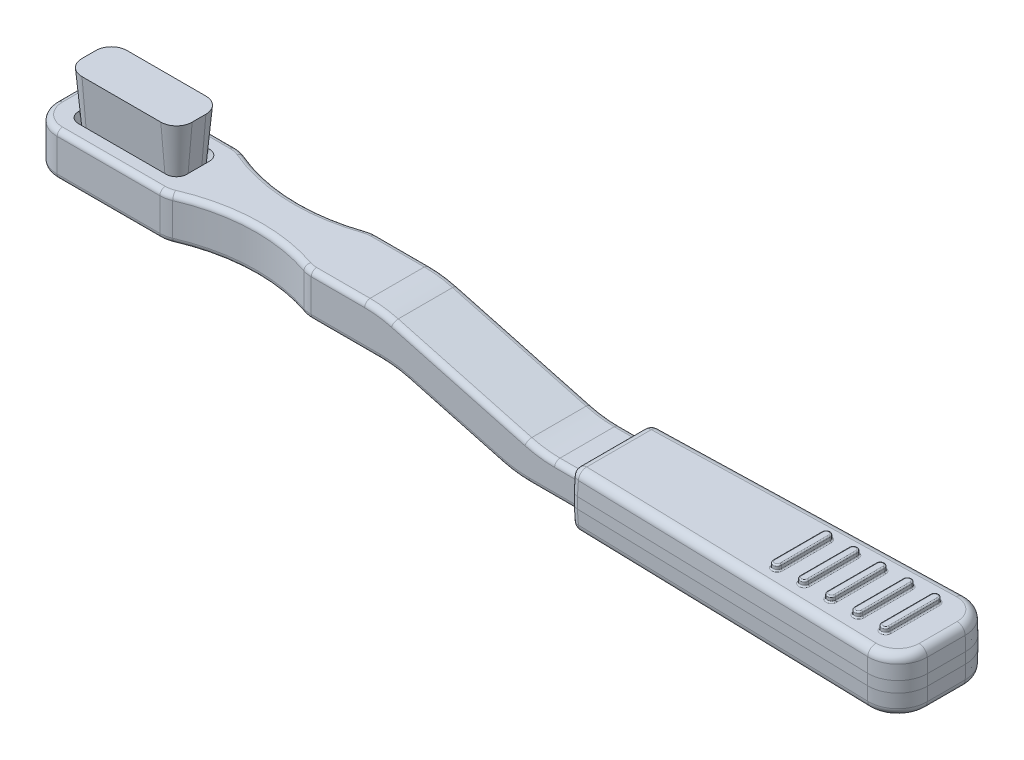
SolidWorks part; units mm, degrees
ref_plane "Front Plane" through (0, 0, 0) normal (0, 0, 1) x (1, 0, 0)
ref_plane "Top Plane" through (0, 0, 0) normal (0, 1, 0) x (1, 0, 0)
ref_plane "Right Plane" through (0, 0, 0) normal (1, 0, 0) x (0, 0, -1)
ref_plane "Plane1" through (0, -3, 0) normal (0, 1, 0) x (1, 0, 0)
sketch "Sketch1" plane through (0, 0, 0) normal (0, 1, 0) x (1, 0, 0)
  line L0 (0, 0) -> (160, 0)
  line L1 (160, 6) -> (49.98, 6)
  line L2 (25, 7) -> (0, 7)
  line L3 (0, 30.525) -> (0, -38.6723) construction
  line L4 (160, 6) -> (160, 0)
  line L5 (0, 7) -> (0, 0)
  arc A0 (49.98, 6) -> (25, 7) centre (38.689, 36.45) cw
  point P11 (37.3899, 4)
  dimension "D2" = 6
  dimension "D1" = 160
  dimension "D3" = 4
  dimension "D4" = 25
  dimension "D5" = 25
  dimension "D6" = 7
extrude "Boss-Extrude1" add sketch "Sketch1" along normal blind 14 contours L2 L5 L0 L4 L1 A0
mirror "Mirror1" about plane through (0, 14, 0) normal (0, 0, -1) of "Boss-Extrude1"
fillet "Fillet1" radius 5 8 edges at (25, 7, -7) (49.98, 7, -6) (49.98, 7, 6) (25, 7, 7) (0, 7, -7) (0, 7, 7) (160, 7, -6) (160, 7, 6)
sketch "Sketch2" plane through (0, 0, 0) normal (0, 0, 1) x (1, 0, 0)
  line L0 (0, 6) -> (66.1273, 6)
  line L1 (0, 0) -> (0, 6) construction
  line L2 (63.3359, 14) -> (93.0687, 6)
  line L3 (155, 14) -> (50.8441, 14) construction
  line L4 (93.0687, 6) -> (160, 6)
  line L5 (160, 14) -> (160, 0) construction
  line L6 (66.1273, 6) -> (88.4268, 0)
  line L7 (155, 0) -> (50.8441, 0) construction
  line L8 (88.4268, 0) -> (160, 0)
  line L9 (160, 0) -> (160, 6)
  line L10 (63.3359, 14) -> (0, 14)
  line L11 (0, 14) -> (0, 6)
  line L12 (0, 6) -> (0, 0)
  line L13 (0, 0) -> (88.4268, 0)
  line L14 (160, 6) -> (160, 14)
  line L15 (160, 14) -> (63.3359, 14)
  point P15 (0, 0)
  point P17 (0, 0)
  point P21 (0, 0)
  point P22 (0, 0)
  point P23 (0, 0)
  point P24 (0, 0)
  point P25 (0, 0)
  point P26 (0, 0)
  point P27 (0, 0)
  dimension "D1" = 8
  dimension "D2" = 29.7328
  dimension "D3" = 6
  dimension "D4" = 7
  dimension "D5" = 63.3359
extrude "Cut-Extrude1" cut sketch "Sketch2" against normal mid plane 20 contours L12 L13 L6 L0 | L14 L15 L2 L4
ref_plane "Plane2" through (0, 3, 0) normal (0, 1, 0) x (1, 0, 0)
fillet "Fillet2" radius 20 4 edges at (88.4268, 0, 0) (66.1273, 6, 0) (63.3359, 14, 0) (93.0687, 6, 0)
sketch "Sketch3" plane through (0, 0, 0) normal (0, 1, 0) x (1, 0, 0)
  line L0 (105, 0) -> (150, 0) construction
  line L1 (105, 3.5) -> (150, 3.5)
  line L2 (105, -3.5) -> (150, -3.5)
  line L8 (115.5, 3.5) -> (117.5, 3.5)
  line L9 (115.5, 3.5) -> (115.5, -3.5)
  line L10 (115.5, -3.5) -> (117.5, -3.5)
  line L11 (117.5, 3.5) -> (117.5, -3.5)
  line L12 (137.5, 3.5) -> (139.5, 3.5)
  line L13 (137.5, 3.5) -> (137.5, -3.5)
  line L14 (137.5, -3.5) -> (139.5, -3.5)
  line L15 (139.5, 3.5) -> (139.5, -3.5)
  arc A0 (105, 3.5) -> (105, -3.5) centre (105, 0) ccw
  arc A1 (150, -3.5) -> (150, 3.5) centre (150, 0) ccw
  point P3 (127.5, 0)
  dimension "D2" = 105
  dimension "D1" = 7
  dimension "D3" = 45
  dimension "D4" = 10
  dimension "D5" = 2
  dimension "D6" = 10
extrude "Cut-Extrude2" cut sketch "Sketch3" along normal through all draft 2
sketch "Sketch4" plane through (0, 14, 0) normal (0, 1, 0) x (1, 0, 0)
  line L0 (24, 0) -> (0, 0) construction
  line L1 (4, 4) -> (24, 4)
  line L2 (4, 4) -> (4, -4)
  line L3 (4, -4) -> (24, -4)
  line L4 (24, 4) -> (24, -4)
  dimension "D1" = 20
  dimension "D2" = 4
  dimension "D3" = 8
extrude "Cut-Extrude3" cut sketch "Sketch4" against normal blind 3 draft 15
fillet "Fillet4" radius 2 4 edges at (23.5981, 12.5, 3.5981) (4.4019, 12.5, 3.5981) (4.4019, 12.5, -3.5981) (23.5981, 12.5, -3.5981)
sketch "Sketch5" plane through (0, 0, 0) normal (0, 0, 1) x (1, 0, 0)
  line L0 (162, 9) -> (99, 9)
  line L1 (99, 9) -> (99, -3)
  line L2 (99, -3) -> (162, -3)
  line L3 (162, -3) -> (162, 9)
  dimension "D1" = 99
  dimension "D2" = 3
  dimension "D3" = 63
  dimension "D4" = 12
sketch "Sketch6" plane through (0, 3, 0) normal (0, 1, 0) x (1, 0, 0)
  line L0 (99, 0) -> (0, 0) construction
  line L1 (162, 9) -> (99, 9) construction
  line L2 (162, 9) -> (162, -9) construction
  line L3 (162, -9) -> (99, -9) construction
  line L4 (99, 9) -> (99, -9) construction
  line L5 (156.3516, -9) -> (100, -7.5)
  line L6 (156.3516, 9) -> (100, 7.5)
  line L7 (162, -3.5) -> (162, 3.5)
  line L8 (100, -7.5) -> (100, 7.5)
  arc A0 (162, -3.5) -> (156.3516, -9) centre (156.4981, -3.5) cw
  arc A1 (156.3516, 9) -> (162, 3.5) centre (156.4981, 3.5) cw
  dimension "D4" = 7
  dimension "D1" = 18
  dimension "D2" = 99
  dimension "D3" = 63
  dimension "D5" = 1
  dimension "D6" = 15
extrude "Boss-Extrude3" add sketch "Sketch6" along normal mid plane 2 separate body contours L5 L8 L6 A1 L7 A0
sketch "Sketch7" plane through (0, 4, 0) normal (0, 1, 0) x (1, 0, 0)
  line L4 (162, -3.5) -> (162, 3.5)
  line L5 (156.3516, 9) -> (100, 7.5)
  line L6 (100, 7.5) -> (100, -7.5)
  line L7 (100, -7.5) -> (156.3516, -9)
  line L8 (162, -3.5) -> (162, 3.5)
  line L9 (156.3516, 9) -> (100, 7.5)
  line L10 (100, 7.5) -> (100, -7.5)
  line L11 (100, -7.5) -> (156.3516, -9)
  arc A2 (156.3516, -9) -> (162, -3.5) centre (156.4981, -3.5) ccw
  arc A3 (162, 3.5) -> (156.3516, 9) centre (156.4981, 3.5) ccw
  arc A4 (156.3516, -9) -> (162, -3.5) centre (156.4981, -3.5) ccw
  arc A5 (162, 3.5) -> (156.3516, 9) centre (156.4981, 3.5) ccw
  dimension "D1" = 0
extrude "Boss-Extrude4" add sketch "Sketch7" along normal blind 4 draft 2
sketch "Sketch8" plane through (0, 2, 0) normal (0, -1, 0) x (1, 0, 0)
  line L4 (156.3516, 9) -> (100, 7.5)
  line L5 (100, 7.5) -> (100, -7.5)
  line L6 (100, -7.5) -> (156.3516, -9)
  line L7 (162, -3.5) -> (162, 3.5)
  line L8 (156.3516, 9) -> (100, 7.5)
  line L9 (100, 7.5) -> (100, -7.5)
  line L10 (100, -7.5) -> (156.3516, -9)
  line L11 (162, -3.5) -> (162, 3.5)
  arc A2 (162, 3.5) -> (156.3516, 9) centre (156.4981, 3.5) ccw
  arc A3 (156.3516, -9) -> (162, -3.5) centre (156.4981, -3.5) ccw
  arc A4 (162, 3.5) -> (156.3516, 9) centre (156.4981, 3.5) ccw
  arc A5 (156.3516, -9) -> (162, -3.5) centre (156.4981, -3.5) ccw
  dimension "D1" = 0
extrude "Boss-Extrude5" add sketch "Sketch8" along normal blind 4 draft 2
fillet "Fillet8" radius 1.5 18 edges at (161.8603, -2, 0) (160.239, -2, -7.3418) (128.2475, -2, -8.1122) (100.1397, -2, 0) (128.2475, -2, 8.1122) (160.239, -2, 7.3418) (128.2475, 8, 8.1122) (100.1397, 8, 0) (128.2475, 8, -8.1122) (160.239, 8, -7.3418) (161.8603, 8, 0) (160.239, 8, 7.3418) (100.0698, 0, -7.432) (100, 3, -7.5) (100.0698, 6, -7.432) (100, 3, 7.5) (100.0698, 6, 7.432) (100.0698, 0, 7.432)
sketch "Sketch9" plane through (0, 8, 0) normal (0, 1, 0) x (1, 0, 0)
  line L0 (0, 0) -> (165, 0) construction
  line L1 (155.25, -4.5) -> (155.25, 4.5) construction
  line L2 (154.5, -4.5) -> (154.5, 4.5)
  line L3 (156, -4.5) -> (156, 4.5)
  line L4 (-5, 0) -> (160, 0) construction
  line L5 (150.25, -4.5) -> (150.25, 4.5) construction
  line L6 (149.5, -4.5) -> (149.5, 4.5)
  line L7 (151, -4.5) -> (151, 4.5)
  line L8 (-10, 0) -> (155, 0) construction
  line L9 (145.25, -4.5) -> (145.25, 4.5) construction
  line L10 (144.5, -4.5) -> (144.5, 4.5)
  line L11 (146, -4.5) -> (146, 4.5)
  line L12 (-15, 0) -> (150, 0) construction
  line L13 (140.25, -4.5) -> (140.25, 4.5) construction
  line L14 (139.5, -4.5) -> (139.5, 4.5)
  line L15 (141, -4.5) -> (141, 4.5)
  line L16 (-20, 0) -> (145, 0) construction
  line L17 (135.25, -4.5) -> (135.25, 4.5) construction
  line L18 (134.5, -4.5) -> (134.5, 4.5)
  line L19 (136, -4.5) -> (136, 4.5)
  arc A0 (154.5, -4.5) -> (156, -4.5) centre (155.25, -4.5) ccw
  arc A1 (156, 4.5) -> (154.5, 4.5) centre (155.25, 4.5) ccw
  arc A2 (149.5, -4.5) -> (151, -4.5) centre (150.25, -4.5) ccw
  arc A3 (151, 4.5) -> (149.5, 4.5) centre (150.25, 4.5) ccw
  arc A4 (144.5, -4.5) -> (146, -4.5) centre (145.25, -4.5) ccw
  arc A5 (146, 4.5) -> (144.5, 4.5) centre (145.25, 4.5) ccw
  arc A6 (139.5, -4.5) -> (141, -4.5) centre (140.25, -4.5) ccw
  arc A7 (141, 4.5) -> (139.5, 4.5) centre (140.25, 4.5) ccw
  arc A8 (134.5, -4.5) -> (136, -4.5) centre (135.25, -4.5) ccw
  arc A9 (136, 4.5) -> (134.5, 4.5) centre (135.25, 4.5) ccw
  point P5 (155.25, 0)
  point P15 (150.25, 0)
  point P24 (145.25, 0)
  point P33 (140.25, 0)
  point P42 (135.25, 0)
  dimension "D1" = 165
  dimension "D2" = 1.5
  dimension "D3" = 9
  dimension "D4" = 9
  dimension "D5" = 5
extrude "Boss-Extrude7" add sketch "Sketch9" along normal blind 1
mirror "Mirror2" about plane through (0, 3, 0) normal (0, 1, 0) of "Boss-Extrude7"
fillet "Fillet9" radius 1 48 edges at (50.022, 6, 5.932) (37.4829, 6, 3.9964) (24.9407, 6, 6.898) (14.468, 6, 7) (1.4645, 6, 5.5355) (0, 6, 0) (1.4645, 6, -5.5355) (14.468, 6, -7) (24.9407, 6, -6.898) (37.4829, 6, -3.9964) (50.022, 6, -5.932) (57.1639, 6, -6) (66.1045, 5.8275, -6) (77.277, 3, -6) (88.4496, 0.1725, -6) (123.0352, 0, -6) (158.5355, 0, -4.5355) (160, 0, 0) (158.5355, 0, 4.5355) (123.0352, 0, 6) (88.4496, 0.1725, 6) (77.277, 3, 6) (66.1045, 5.8275, 6) (50.022, 14, 5.932) (55.7682, 14, 6) (63.3131, 13.8275, 6) (78.2023, 10, 6) (93.0915, 6.1725, 6) (125.3562, 6, 6) (158.5355, 6, 4.5355) (160, 6, 0) (158.5355, 6, -4.5355) (125.3562, 6, -6) (93.0915, 6.1725, -6) (78.2023, 10, -6) (63.3131, 13.8275, -6) (55.7682, 14, -6) (50.022, 14, -5.932) (37.4829, 14, -3.9964) (24.9407, 14, -6.898) (14.468, 14, -7) (1.4645, 14, -5.5355) (0, 14, 0) (1.4645, 14, 5.5355) (14.468, 14, 7) (24.9407, 14, 6.898) (57.1639, 6, 6) (37.4829, 14, 3.9964)
fillet "Fillet10" radius 0.25 80 edges at (145.25, -3, -5.25) (146, -3, 0) (145.25, -3, 5.25) (145.25, -2, -5.25) (146, -2, 0) (145.25, -2, 5.25) (155.25, -3, -5.25) (156, -3, 0) (155.25, -3, 5.25) (155.25, -2, -5.25) (156, -2, 0) (155.25, -2, 5.25) (150.25, -3, -5.25) (151, -3, 0) (150.25, -3, 5.25) (150.25, -2, -5.25) (151, -2, 0) (150.25, -2, 5.25) (140.25, -3, -5.25) (141, -3, 0) (140.25, -3, 5.25) (140.25, -2, -5.25) (141, -2, 0) (140.25, -2, 5.25) (135.25, -3, 5.25) (134.5, -3, 0) (135.25, -3, -5.25) (135.25, -2, 5.25) (134.5, -2, 0) (135.25, -2, -5.25) (155.25, 9, -5.25) (156, 9, 0) (155.25, 9, 5.25) (155.25, 8, -5.25) (156, 8, 0) (155.25, 8, 5.25) (150.25, 9, -5.25) (151, 9, 0) (150.25, 9, 5.25) (150.25, 8, -5.25) (151, 8, 0) (150.25, 8, 5.25) (145.25, 9, -5.25) (146, 9, 0) (145.25, 9, 5.25) (145.25, 8, -5.25) (146, 8, 0) (145.25, 8, 5.25) (140.25, 9, -5.25) (141, 9, 0) (140.25, 9, 5.25) (140.25, 8, -5.25) (141, 8, 0) (140.25, 8, 5.25) (135.25, 9, 5.25) (134.5, 9, 0) (135.25, 9, -5.25) (135.25, 8, -5.25) (136, 8, 0) (135.25, 8, 5.25) (144.5, -3, 0) (144.5, -2, 0) (154.5, -3, 0) (154.5, -2, 0) (149.5, -3, 0) (149.5, -2, 0) (139.5, -3, 0) (139.5, -2, 0) (136, -3, 0) (136, -2, 0) (154.5, 9, 0) (154.5, 8, 0) (149.5, 9, 0) (149.5, 8, 0) (144.5, 9, 0) (144.5, 8, 0) (139.5, 9, 0) (139.5, 8, 0) (136, 9, 0) (134.5, 8, 0)
sketch "Sketch10" plane through (0, 11, 0) normal (0, 1, 0) x (1, 0, 0)
  line L4 (6.7357, -3.1962) -> (21.2643, -3.1962)
  line L5 (23.1962, -1.2643) -> (23.1962, 1.2643)
  line L6 (21.2643, 3.1962) -> (6.7357, 3.1962)
  line L7 (4.8038, 1.2643) -> (4.8038, -1.2643)
  line L8 (6.7357, -3.1962) -> (21.2643, -3.1962)
  line L9 (23.1962, -1.2643) -> (23.1962, 1.2643)
  line L10 (21.2643, 3.1962) -> (6.7357, 3.1962)
  line L11 (4.8038, 1.2643) -> (4.8038, -1.2643)
  ellipse E4 centre (21.1256, -1.1256) end of major axis (19.6133, 0.3867) minor radius 2 (21.2643, -3.1962) -> (23.1962, -1.2643) ccw
  ellipse E5 centre (21.1256, 1.1256) end of major axis (19.6133, -0.3867) minor radius 2 (23.1962, 1.2643) -> (21.2643, 3.1962) ccw
  ellipse E6 centre (6.8744, 1.1256) end of major axis (8.3867, -0.3867) minor radius 2 (6.7357, 3.1962) -> (4.8038, 1.2643) ccw
  ellipse E7 centre (6.8744, -1.1256) end of major axis (8.3867, 0.3867) minor radius 2 (4.8038, -1.2643) -> (6.7357, -3.1962) ccw
  ellipse E8 centre (21.1256, -1.1256) end of major axis (19.6133, 0.3867) minor radius 2 (21.2643, -3.1962) -> (23.1962, -1.2643) ccw
  ellipse E9 centre (21.1256, 1.1256) end of major axis (19.6133, -0.3867) minor radius 2 (23.1962, 1.2643) -> (21.2643, 3.1962) ccw
  ellipse E10 centre (6.8744, 1.1256) end of major axis (8.3867, -0.3867) minor radius 2 (6.7357, 3.1962) -> (4.8038, 1.2643) ccw
  ellipse E11 centre (6.8744, -1.1256) end of major axis (8.3867, 0.3867) minor radius 2 (4.8038, -1.2643) -> (6.7357, -3.1962) ccw
  dimension "D1" = 0
extrude "Boss-Extrude8" add sketch "Sketch10" along normal blind 11 draft 5 separate body
